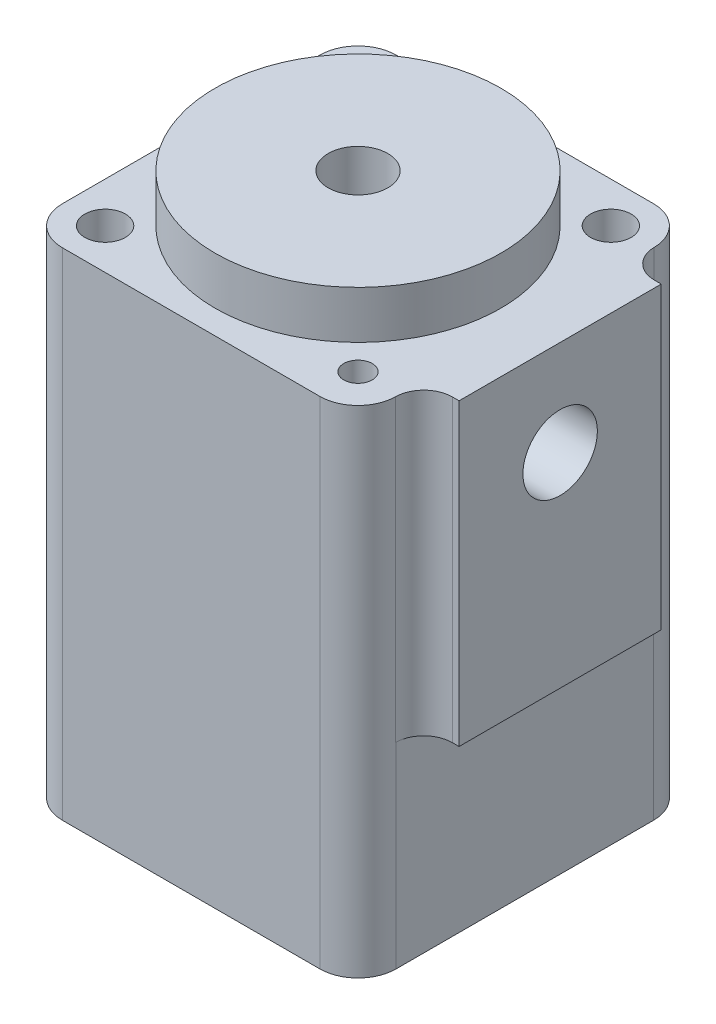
SolidWorks part; units mm, degrees
ref_plane "Front Plane" through (0, 0, 0) normal (0, 0, 1) x (1, 0, 0)
ref_plane "Top Plane" through (0, 0, 0) normal (0, 1, 0) x (1, 0, 0)
ref_plane "Right Plane" through (0, 0, 0) normal (1, 0, 0) x (0, 0, -1)
sketch "Sketch2" plane through (0, 0, 0) normal (0, 1, 0) x (1, 0, 0)
  line L1 (-22.225, -22.225) -> (22.225, -22.225)
  line L2 (-22.225, -22.225) -> (-22.225, 22.225)
  line L3 (-22.225, 22.225) -> (22.225, 22.225)
  line L4 (22.225, -22.225) -> (22.225, 22.225)
  line L5 (-22.225, -22.225) -> (22.225, 22.225) construction
  line L6 (-22.225, 22.225) -> (22.225, -22.225) construction
  point P0 (0, 0)
  dimension "D1" = 44.45
  dimension "D2" = 44.45
extrude "Boss-Extrude1" add sketch "Sketch2" along normal blind 66.04
sketch "Sketch3" plane through (0, 66.04, 0) normal (0, 1, 0) x (1, 0, 0)
  circle A0 centre (0, 0) radius 19.0373
  dimension "D1" = 38.0746
extrude "Boss-Extrude2" add sketch "Sketch3" along normal blind 6.35
sketch "Sketch4" plane through (0, 72.39, 0) normal (0, 1, 0) x (1, 0, 0)
  circle A0 centre (0, 0) radius 3.9688
  dimension "D1" = 7.9375
extrude "Cut-Extrude1" cut sketch "Sketch4" against normal blind 38.1
hole_wizard "7/16-20 Tapped Hole1" positions "Sketch6" profile "Sketch5" tap size "7/16-20" standard "Ansi Inch"
sketch "Sketch6" plane through (0, 0, 0) normal (0, -1, 0) x (1, 0, 0)
  line L0 (0, 22.225) -> (0, -22.225) construction
  line L1 (-22.225, 22.225) -> (22.225, 22.225) construction
  line L2 (22.225, -22.225) -> (-22.225, -22.225) construction
  line L3 (0, 0) -> (-13.2065, 0) construction
  point P0 (0, 9.525)
  point P1 (0, -9.525)
  dimension "D1" = 19.05
  dimension "D2" = 9.525
sketch "Sketch5" plane through (0, 0, 9.525) normal (1, 0, 0) x (0, 0, -1)
  line L0 (0, 0) -> (0, 26.162)
  line L1 (0, 26.162) -> (4.9606, 26.162)
  line L2 (4.9606, 26.162) -> (4.9606, 0)
  line L5 (4.9606, 0) -> (0, 0)
  line L10 (0, 26.162) -> (-4.9606, 26.162) construction
  line L11 (0, -6.35) -> (0, 107.95) construction
  dimension "Tap Drill Dia." = 9.9212
  dimension "Tap Drill Depth" = 26.162
  dimension "Drill Angle" = 180
fillet "Fillet1" radius 5.08 4 edges at (-22.225, 33.02, -22.225) (-22.225, 33.02, 22.225) (22.225, 33.02, -22.225) (22.225, 33.02, 22.225)
sketch "Sketch7" plane through (0, 66.04, 0) normal (0, 1, 0) x (1, 0, 0)
  line L0 (22.225, 0) -> (26.924, 0) construction
  line L1 (22.225, -17.145) -> (22.225, 17.145) construction
  line L2 (22.225, 13.462) -> (26.924, 13.462)
  line L3 (26.924, 13.462) -> (26.924, -13.462)
  line L4 (26.924, -13.462) -> (22.225, -13.462)
  line L5 (0, 0) -> (0, 17.5841) construction
  line L6 (22.225, 13.462) -> (22.225, -13.462)
  dimension "D1" = 26.924
  dimension "D2" = 26.924
extrude "Boss-Extrude3" add sketch "Sketch7" against normal blind 39.878
fillet "Fillet3" radius 3.81 2 edges at (22.225, 46.101, 13.462) (22.225, 46.101, -13.462)
hole_wizard "7/16-20 Tapped Hole2" positions "Sketch9" profile "Sketch8" tap size "7/16-20" standard "Ansi Inch"
sketch "Sketch9" plane through (26.924, 0, 0) normal (1, 0, 0) x (0, 0, -1)
  line L0 (0, 66.04) -> (0, 26.162) construction
  line L1 (-13.462, 66.04) -> (13.462, 66.04) construction
  line L2 (17.145, 26.162) -> (-17.145, 26.162) construction
  point P0 (0, 53.34)
  dimension "D1" = 12.7
sketch "Sketch8" plane through (26.924, 53.34, 0) normal (0, 1, 0) x (0, 0, -1)
  line L0 (0, 0) -> (0, 26.162)
  line L1 (0, 26.162) -> (4.9606, 26.162)
  line L2 (4.9606, 26.162) -> (4.9606, 0)
  line L5 (4.9606, 0) -> (0, 0)
  line L10 (0, 26.162) -> (-4.9606, 26.162) construction
  line L11 (0, -6.35) -> (0, 107.95) construction
  dimension "Tap Drill Dia." = 9.9212
  dimension "Tap Drill Depth" = 26.162
  dimension "Drill Angle" = 180
hole_wizard "#10-24 Tapped Hole1" positions "Sketch11" profile "Sketch10" tap size "#10-24" standard "ANSI Inch"
sketch "Sketch11" plane through (0, 66.04, 0) normal (0, 1, 0) x (-1, 0, 0)
  line L1 (0, 0) -> (0, 23.47) construction
  point P0 (16.8402, -16.8402)
  point P1 (-16.8402, 16.8402)
  dimension "D1" = 16.8402
  dimension "D2" = 16.8402
  dimension "D3" = 16.8402
  dimension "D4" = 16.8402
sketch "Sketch10" plane through (-16.8402, 66.04, -16.8402) normal (1, 0, 0) x (0, 0, 1)
  line L0 (0, 0) -> (0, 66.04)
  line L1 (0, 66.04) -> (1.8986, 66.04)
  line L2 (1.8986, 66.04) -> (1.8986, 0)
  line L5 (1.8986, 0) -> (0, 0)
  line L11 (0, -6.35) -> (0, 107.95) construction
  dimension "Thru Tap Drill Dia." = 3.7973
  dimension "Thru Tap Drill Depth" = 66.04
hole_wizard "#3 (0.213) Diameter Hole1" positions "Sketch13" profile "Sketch14" hole size "#3" standard "Ansi Inch"
sketch "Sketch13" plane through (0, 66.04, 0) normal (0, 1, 0) x (-1, 0, 0)
  line L1 (0, 0) -> (0, 17.4002) construction
  point P0 (-16.8402, -16.8402)
  point P1 (16.8402, 16.8402)
  dimension "D1" = 16.8402
  dimension "D2" = 16.8402
  dimension "D3" = 16.8402
  dimension "D4" = 16.8402
sketch "Sketch14" plane through (16.8402, 66.04, -16.8402) normal (1, 0, 0) x (0, 0, 1)
  line L0 (0, 0) -> (0, 66.04)
  line L1 (0, 66.04) -> (2.7051, 66.04)
  line L2 (2.7051, 66.04) -> (2.7051, 0)
  line L5 (2.7051, 0) -> (0, 0)
  line L11 (0, -6.35) -> (0, 107.95) construction
  dimension "Thru Hole Dia." = 5.4102
  dimension "Thru Hole Depth" = 66.04
sketch "Sketch15" [suppressed] plane through (0, 0, 0) normal (0, -1, 0) x (1, 0, 0)
  arc A0 (4.0506, 0) -> (-4.0506, 0) centre (0, 9.525) ccw
  arc A1 (-4.0506, 0) -> (4.0506, 0) centre (0, -9.525) ccw
  circle A2 centre (0, 9.525) radius 4.9606 construction
  circle A3 centre (0, -9.525) radius 4.9606 construction
  dimension "D1" = 20.701
  dimension "D2" = 20.701
extrude "Cut-Extrude2" [suppressed] cut sketch "Sketch15" against normal blind 0.254
sketch "Sketch21" plane through (41.275, 0, -41.275) normal (0, 1, 0) x (1, 0, 0)
  line L0 (-41.275, -47.625) -> (-41.275, -53.975) construction
  line L1 (-38.1, -50.8) -> (-44.45, -50.8) construction
  line L4 (-41.275, -63.5) -> (-41.275, -19.05) construction
  line L5 (-58.42, -63.5) -> (-24.13, -63.5) construction
  line L6 (-24.13, -19.05) -> (-58.42, -19.05) construction
  line L7 (-41.275, -41.275) -> (-69.2947, -41.275) construction
  circle A0 centre (-41.275, -50.8) radius 3.175
  point P4 (-41.275, -50.8)
  dimension "D1" = 9.525
  dimension "D3" = 6.35
ref_plane "Plane1" through (0, 0, 9.525) normal (0, 0, 1) x (1, 0, 0)
sketch "Port Sketch" plane through (-41.1418, 0, 9.525) normal (0, 0, -1) x (-1, 0, 0)
  line L0 (-41.1418, 0) -> (-41.1418, 45.0293) construction
  line L1 (-41.1418, 17.2346) -> (-36.1811, 14.254)
  line L2 (-36.1811, 14.254) -> (-36.1811, 11.754)
  line L3 (-36.1811, 11.754) -> (-35.5855, 11.754)
  line L4 (-35.5855, 11.754) -> (-35.5855, 2.7644)
  line L5 (-35.5855, 2.7644) -> (-35.6751, 2.854)
  line L6 (-35.6751, 2.854) -> (-35.1652, 0.4552)
  line L7 (-34.9168, 0.254) -> (-30.6418, 0.254)
  line L8 (-30.6418, 0.254) -> (-30.6418, 0)
  line L10 (-30.6418, 0) -> (-41.1418, 0)
  line L11 (-41.1418, 0) -> (-41.1418, 17.2346)
  line L12 (-46.6084, 2.854) -> (-47.1183, 0.4552) construction
  line L13 (-46.698, 2.7644) -> (-46.6084, 2.854) construction
  line L14 (-41.1418, 17.2346) -> (-46.1024, 14.254) construction
  arc A0 (-35.1652, 0.4552) -> (-34.9168, 0.254) centre (-34.9168, 0.508) ccw
  dimension "D1" = 0.254
  dimension "Countersink angle" = 118
  dimension "D3" = 45
  dimension "TapDrillDia" = 9.9212
  dimension "D5" = 12.45
  dimension "ThdMjr" = 11.1125
  dimension "SpotDia" = 21
  dimension "L3" = 0.254
  dimension "L1" = 2.6
  dimension "ThdDp" = 11.5
  dimension "TapDrillDp" = 14
  dimension "K" = 12
revolve "SAE Port" cut sketch "Port Sketch" angle 360 about L0
other "sae j1926-1 (rectangular face)<1>"
pattern_linear "LPattern1" count 2 spacing 19.05 along (0, 0, -1) of "SAE Port"
sketch "Sketch22" plane through (0, 0, 0) normal (0, 0, 1) x (1, 0, 0)
sketch "Sketch23" plane through (0, 0, 0) normal (0, 0, 1) x (1, 0, 0)
  line L0 (0, 0) -> (0, 75.9121) construction
  line L1 (-17.145, 0) -> (17.145, 0) construction
  line L2 (19.0373, 72.39) -> (-19.0373, 72.39) construction
  line L3 (0, 46.99) -> (-3.9624, 46.99)
  line L4 (0, 46.99) -> (0, 85.09)
  line L5 (0, 85.09) -> (-3.9624, 85.09)
  line L6 (-3.9624, 46.99) -> (-3.9624, 85.09)
  dimension "D1" = 7.9248
  dimension "D2" = 12.7
  dimension "D3" = 25.4
revolve "Revolve1" [suppressed] add sketch "Sketch23" angle 360 about L0
